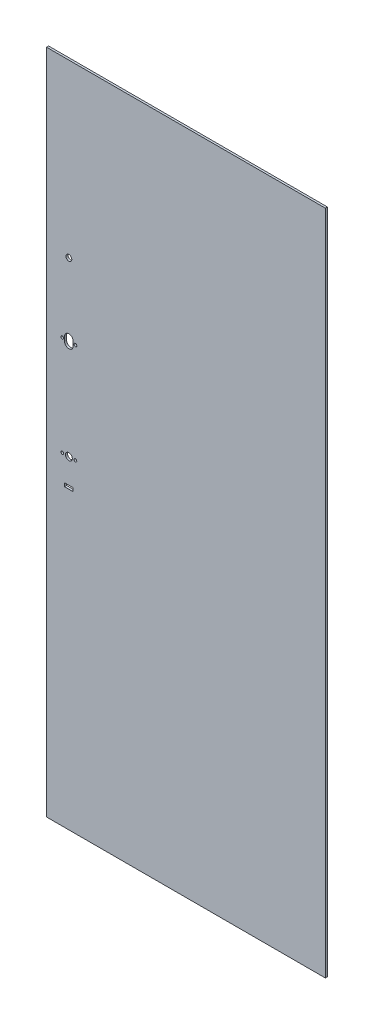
SolidWorks part; units mm, degrees
ref_plane "Спереди" through (0, 0, 0) normal (0, 0, 1) x (1, 0, 0)
ref_plane "Сверху" through (0, 0, 0) normal (0, 1, 0) x (1, 0, 0)
ref_plane "Справа" through (0, 0, 0) normal (1, 0, 0) x (0, 0, -1)
sketch "Эскиз1" plane through (0, 0, 0) normal (0, 0, 1) x (1, 0, 0)
  line L0 (406.9, -970.8) -> (-405.9, -970.8) construction
  line L1 (-404.5, -969.1) -> (405.5, -969.1)
  line L2 (-404.5, -969.1) -> (-404.5, 967.9)
  line L3 (-404.5, 967.9) -> (405.5, 967.9)
  line L4 (405.5, -969.1) -> (405.5, 967.9)
  line L5 (-405.9, -970.8) -> (-405.9, 969.6) construction
  line L6 (406.9, 969.6) -> (406.9, -969.6) construction
  line L7 (-405.9, 969.6) -> (406.9, 969.6) construction
  dimension "D1" = 1.7
  dimension "D2" = 1.4
  dimension "D3" = 1.4
  dimension "D4" = 1.7
extrude "Бобышка-Вытянуть1" add sketch "Эскиз1" along normal blind 6
extrude "Вырез-Вытянуть1" cut sketch "Эскиз2" against normal through all both and the other way through all
sketch "Эскиз2" plane through (0, 0, -92) normal (0, 0, -1) x (-1, 0, 0)
  line L0 (0, -1029.8) -> (0, 470.2) construction
  line L2 (0, 470.2) -> (339.7, 470.2) construction
  line L54 (352.2, -101.8) -> (327.2, -101.8)
  line L55 (352.2, -111.8) -> (352.2, -101.8)
  line L60 (327.2, -111.8) -> (352.2, -111.8)
  line L61 (327.2, -101.8) -> (327.2, -111.8)
  line L62 (352.2, 254.15) -> (352.2, 266.65)
  line L63 (327.2, 266.65) -> (327.2, 254.15)
  circle A0 centre (0, 470.2) radius 8.5 construction
  circle A1 centre (339.7, 470.2) radius 8.5
  circle A47 centre (339.7, -29.8) radius 10
  circle A59 centre (358.7, -29.8) radius 4
  circle A62 centre (320.7, -29.8) radius 4
  circle A64 centre (358.7, 260.4) radius 4.1
  circle A66 centre (320.7, 260.4) radius 4.1
  arc A70 (327.2, 254.15) -> (352.2, 254.15) centre (339.7, 254.15) ccw
  arc A71 (352.2, 266.65) -> (327.2, 266.65) centre (339.7, 266.65) ccw
extrude "Вырез-Вытянуть2" cut sketch "Эскиз3" along normal through all both
sketch "Эскиз3" plane through (0, 0, 0) normal (0, 0, 1) x (1, 0, 0)
  line L4 (-383.4, 121.55) -> (-391.9, 121.55)
  line L5 (-391.9, 103.55) -> (-383.4, 103.55)
  arc A4 (-391.9, 121.55) -> (-391.9, 103.55) centre (-391.9, 112.55) ccw
  arc A5 (-383.4, 103.55) -> (-383.4, 121.55) centre (-383.4, 112.55) ccw
sketch "Эскиз6" [suppressed] plane through (0, 0, 6) normal (0, 0, 1) x (1, 0, 0)
  line L0 (-258, 802) -> (258, 802)
  line L1 (-148, 692) -> (148, 692) construction
  line L2 (-148, 692) -> (-148, -692) construction
  line L3 (-148, -692) -> (148, -692) construction
  line L4 (148, 692) -> (148, -692) construction
  line L5 (258, 802) -> (258, -802)
  line L6 (-258, -802) -> (258, -802)
  line L7 (-258, 802) -> (-258, -802)
  dimension "D1" = 110
extrude "Фрезеровка Неаполь" [suppressed] cut sketch "Эскиз6" against normal blind 0.5 contours L7 L6 L5 L0
extrude "Вырез-Вытянуть5" cut sketch "Эскиз7" along normal through all both
sketch "Эскиз7" plane through (0, 0, 0) normal (0, 0, 1) x (1, 0, 0)
  circle A2 centre (-340.2, 131.8) radius 10
extrude "Вырез-Вытянуть6" cut sketch "Эскиз8" along normal through all both
sketch "Эскиз8" plane through (0, 0, 0) normal (0, 0, 1) x (1, 0, 0)
  line L0 (-339.7, -106.8) -> (-339.7, -119.8) construction
  line L1 (-347.7, -119.8) -> (-331.7, -119.8) construction
  circle A0 centre (-347.7, -119.8) radius 5
  circle A1 centre (-331.7, -119.8) radius 5
sketch "Эскиз11" [suppressed] plane through (0, 0, 6) normal (0, 0, 1) x (1, 0, 0)
  circle A0 centre (-339.7, -29.8) radius 32.5
  dimension "D1" = 65
extrude "Бобышка-Вытянуть3" [suppressed] add sketch "Эскиз11" against normal up to surface (6 mm away)
sketch "Эскиз13" [suppressed] plane through (0, 0, 6) normal (0, 0, 1) x (1, 0, 0)
  circle A0 centre (-331.7, -119.8) radius 5 construction
  circle A1 centre (-347.7, -119.8) radius 5 construction
  circle A2 centre (-331.7, -119.8) radius 5
  circle A3 centre (-347.7, -119.8) radius 5
extrude "Бобышка-Вытянуть4" [suppressed] add sketch "Эскиз13" against normal up to surface (6 mm away)
sketch "Эскиз14" plane through (0, 0, 6) normal (0, 0, 1) x (1, 0, 0)
  line L0 (405.5, -969.1) -> (405.5, 967.9) construction
  line L1 (-404.5, 967.9) -> (405.5, 967.9)
  line L2 (-404.5, 967.9) -> (-404.5, -969.1)
  line L3 (-404.5, -969.1) -> (405.5, -969.1)
  line L4 (405.5, 967.9) -> (405.5, -969.1)
  line L6 (-388.5, 951.9) -> (389.5, 951.9)
  line L7 (-388.5, 951.9) -> (-388.5, -953.1)
  line L8 (-388.5, -953.1) -> (389.5, -953.1)
  line L9 (389.5, 951.9) -> (389.5, -953.1)
  dimension "D1" = 16
  dimension "D2" = 16
  dimension "D3" = 16
  dimension "D4" = 16
